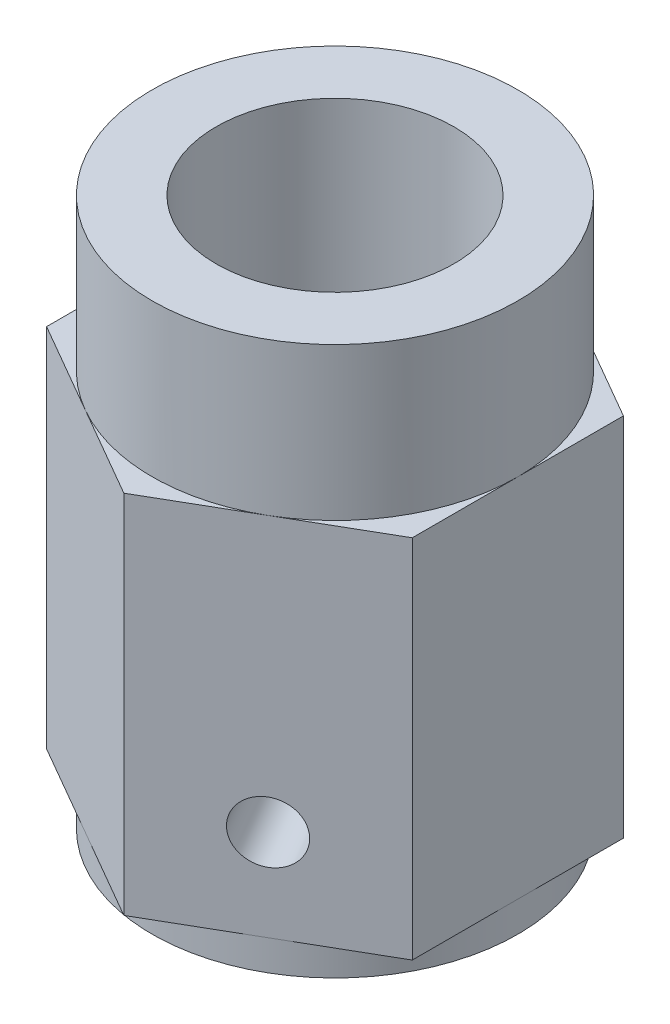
SolidWorks part; units mm, degrees
ref_plane "前视基准面" through (0, 0, 0) normal (0, 0, 1) x (1, 0, 0)
ref_plane "上视基准面" through (0, 0, 0) normal (0, 1, 0) x (1, 0, 0)
ref_plane "右视基准面" through (0, 0, 0) normal (1, 0, 0) x (0, 0, -1)
sketch "草图1" plane through (0, 0, 0) normal (0, 1, 0) x (1, 0, 0)
  line L1 (0, 34.641) -> (-30, 17.3205)
  line L2 (-30, 17.3205) -> (-30, -17.3205)
  line L3 (-30, -17.3205) -> (0, -34.641)
  line L4 (0, -34.641) -> (30, -17.3205)
  line L5 (30, -17.3205) -> (30, 17.3205)
  line L6 (30, 17.3205) -> (0, 34.641)
  circle A0 centre (0, 0) radius 30 construction
extrude "凸台-拉伸1" add sketch "草图1" along normal blind 60
sketch "草图2" plane through (0, 60, 0) normal (0, 1, 0) x (1, 0, 0)
  circle A0 centre (0, 0) radius 30
extrude "凸台-拉伸2" add sketch "草图2" along normal blind 25
sketch "草图3" plane through (0, 0, 0) normal (0, -1, 0) x (1, 0, 0)
  circle A0 centre (0, 0) radius 30
extrude "凸台-拉伸3" add sketch "草图3" along normal blind 5
sketch "草图4" plane through (0, -5, 0) normal (0, -1, 0) x (1, 0, 0)
  circle A0 centre (0, 0) radius 15
extrude "切除-拉伸1" cut sketch "草图4" against normal blind 45
sketch "草图5" plane through (0, 85, 0) normal (0, 1, 0) x (1, 0, 0)
  circle A0 centre (0, 0) radius 19.5
extrude "切除-拉伸2" cut sketch "草图5" against normal blind 45
sketch "草图6" plane through (-30, 0, 0) normal (-1, 0, 0) x (0, 0, 1)
  line L0 (-30, -5) -> (30, -5) construction
  circle A0 centre (0, 15) radius 5
  dimension "D1" = 20
extrude "切除-拉伸3" cut sketch "草图6" against normal up to surface (15.8579 mm away)
sketch "草图7" plane through (15, 0, 25.9808) normal (0.5, 0, 0.866) x (0.866, 0, -0.5)
  line L0 (-30, -5) -> (30, -5) construction
  circle A0 centre (0, 15) radius 5
  dimension "D1" = 20
extrude "切除-拉伸4" cut sketch "草图7" against normal up to surface (15.8579 mm away)
sketch "草图8" plane through (15, 0, -25.9808) normal (0.5, 0, -0.866) x (-0.866, 0, -0.5)
  line L0 (-30, -5) -> (30, -5) construction
  circle A0 centre (0, 15) radius 5
  dimension "D1" = 20
extrude "切除-拉伸5" cut sketch "草图8" against normal up to surface (15.8579 mm away)
